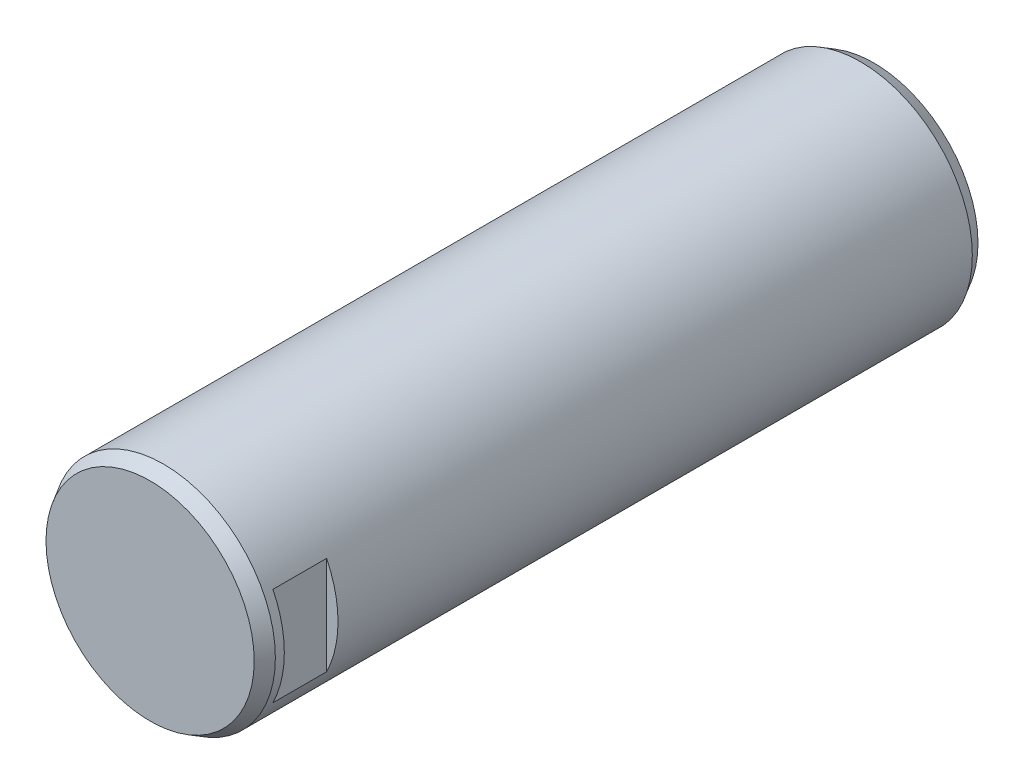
SolidWorks part; units mm, degrees
ref_plane "Front Plane" through (0, 0, 0) normal (0, 0, 1) x (1, 0, 0)
ref_plane "Top Plane" through (0, 0, 0) normal (0, 1, 0) x (1, 0, 0)
ref_plane "Right Plane" through (0, 0, 0) normal (1, 0, 0) x (0, 0, -1)
sketch "Sketch1" plane through (0, 0, 0) normal (0, 0, 1) x (1, 0, 0)
  circle A0 centre (0, 0) radius 25
  dimension "D1" = 50
extrude "Boss-Extrude1" add sketch "Sketch1" along normal mid plane 161.78
chamfer "Chamfer1" distance 3 angle 30 1 edges at (25, 0, 80.89)
chamfer "Chamfer2" distance 3 angle 30 1 edges at (25, 0, -80.89)
ref_plane "Plane1" through (25, 0, 0) normal (1, 0, 0) x (0, 0, -1)
sketch "Sketch2" plane through (25, 0, 0) normal (1, 0, 0) x (0, 0, -1)
  line L0 (0, 0) -> (-63.89, 0) construction
  line L1 (-75.89, 21.1608) -> (-63.89, 21.1608)
  line L2 (-75.89, 21.1608) -> (-75.89, -21.1608)
  line L3 (-75.89, -21.1608) -> (-63.89, -21.1608)
  line L4 (-63.89, 21.1608) -> (-63.89, -21.1608)
  line L5 (-80.89, 23.2679) -> (-80.89, -23.2679) construction
  dimension "D1" = 12
  dimension "D2" = 5
extrude "Cut-Extrude1" cut sketch "Sketch2" against normal blind 2.54
